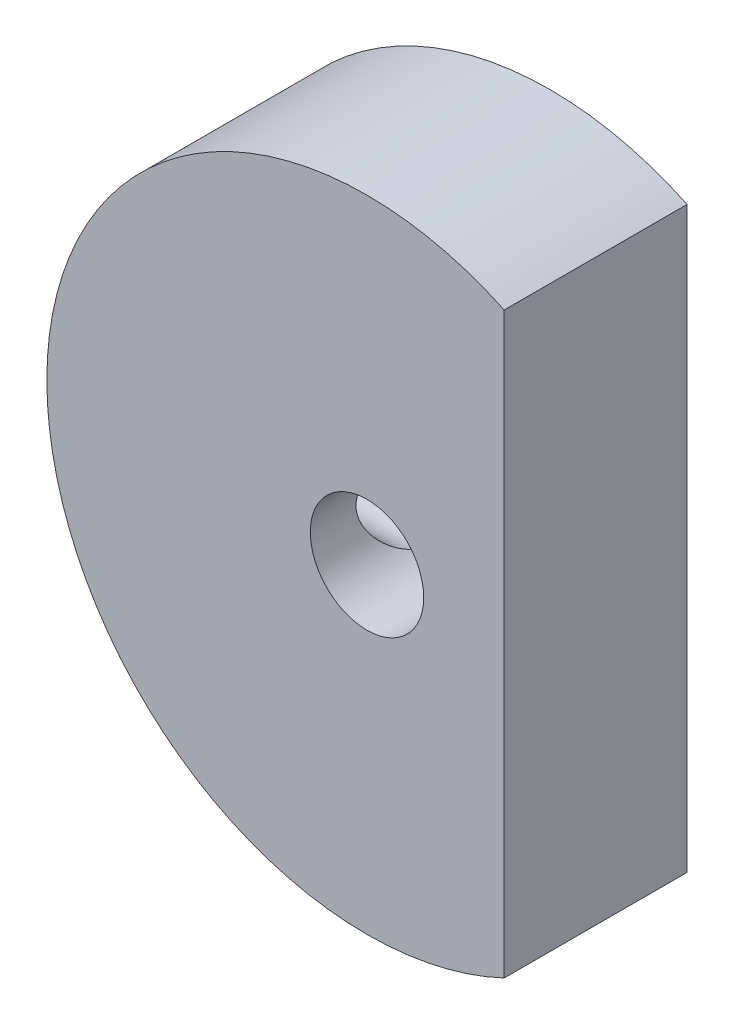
SolidWorks part; units mm, degrees
ref_plane "Plan de face" through (0, 0, 0) normal (0, 0, 1) x (1, 0, 0)
ref_plane "Plan de dessus" through (0, 0, 0) normal (0, 1, 0) x (1, 0, 0)
ref_plane "Plan de droite" through (0, 0, 0) normal (1, 0, 0) x (0, 0, -1)
sketch "Esquisse1" plane through (0, 0, 0) normal (0, 0, 1) x (1, 0, 0)
  line L0 (7.5, 15.8114) -> (7.5, -15.8114)
  circle A0 centre (0, 0) radius 3.1
  arc A1 (7.5, 15.8114) -> (7.5, -15.8114) centre (0, 0) ccw
  dimension "D1" = 6.2
  dimension "D2" = 35
  dimension "D3" = 25
extrude "Extrusion1" add sketch "Esquisse1" along normal mid plane 10
hole_wizard "Trou taraudé M6x1.01" positions "Esquisse3D1" profile "Esquisse2" tap size "M6x1.0" standard "ISO"
sketch3d "Esquisse3D1"
  line L0 (0, 0, 0) -> (-17.5, 0, 0) construction
  point P0 (-17.5, 0, 0)
sketch "Esquisse2" plane through (-17.5, 0, 0) normal (0, 1, 0) x (0, 0, 1)
  line L0 (0, 0) -> (0, 19.0012)
  line L1 (0, 19.0012) -> (2.5, 17.499)
  line L2 (2.5, 17.499) -> (2.5, 0)
  line L5 (2.5, 0) -> (0, 0)
  line L10 (0, 19.0012) -> (-2.5, 17.499) construction
  line L11 (0, -6.35) -> (0, 107.95) construction
  dimension "Diamètre du trou pour taraudage" = 5
  dimension "Profondeur du trou pour taraudage" = 17.499
  dimension "Angle de pointe" = 118
